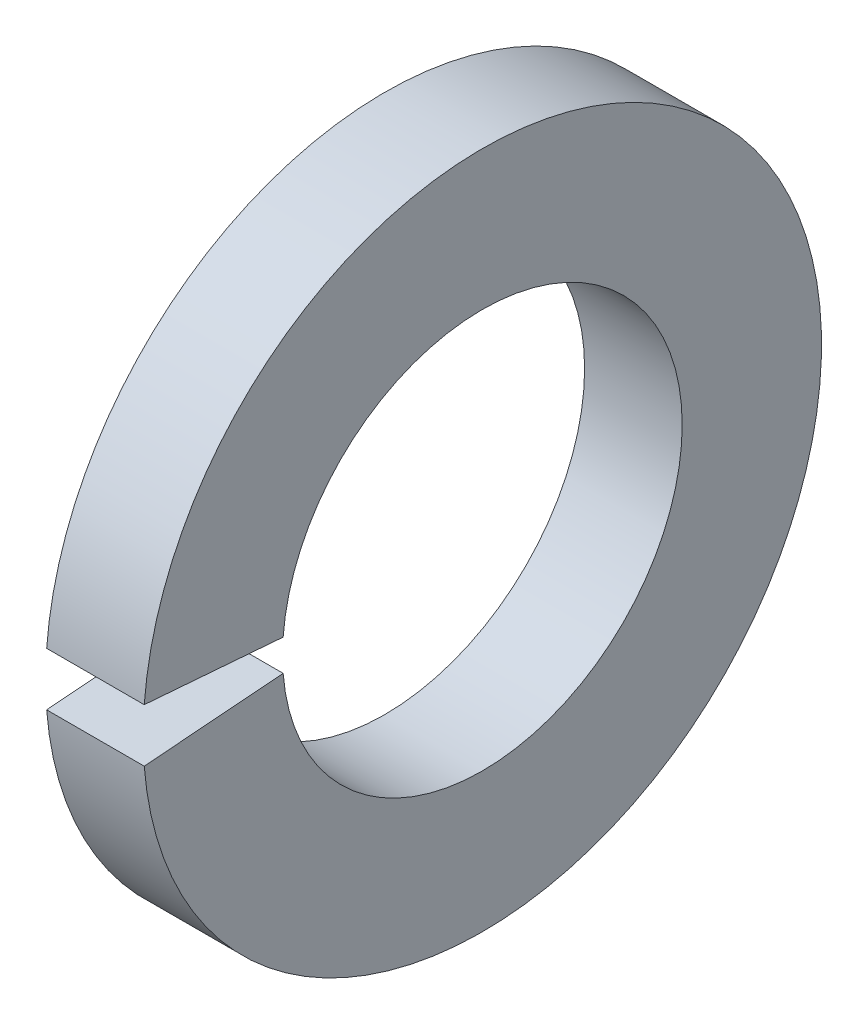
SolidWorks part; units mm, degrees
ref_plane "Plane1" through (0, 0, 0) normal (0, 0, 1) x (1, 0, 0)
ref_plane "Plane2" through (0, 0, 0) normal (0, 1, 0) x (1, 0, 0)
ref_plane "Plane3" through (0, 0, 0) normal (1, 0, 0) x (0, 0, -1)
sketch "Sketch1" plane through (0, 0, 0) normal (0, 0, 1) x (1, 0, 0)
  line L0 (-34.925, 0) -> (9.525, 0) construction
  line L1 (0, 6.5024) -> (0, 11.0363)
  line L2 (0, 11.0363) -> (-3.175, 11.0363)
  line L3 (-3.175, 11.0363) -> (-3.175, 6.5024)
  line L4 (-3.175, 6.5024) -> (0, 6.5024)
  dimension "Thickness" = 3.175
  dimension "Inside_dia" = 13.0048
  dimension "Outside_dia" = 22.0726
revolve "Base-Revolve" add sketch "Sketch1" angle 360 about L0
sketch "Sketch2" plane through (0, 0, 0) normal (-1, 0, 0) x (0, -1, 0)
  line L0 (0, 0) -> (0.8832, 11.2223)
  line L1 (0, -3.175) -> (0, 12.7) construction
  line L2 (0, 0) -> (-0.8832, 11.2223)
  arc A0 (0.8832, 11.2223) -> (-0.8832, 11.2223) centre (0, 0) ccw
  dimension "D1" = 11.257
  dimension "Gap_ang" = 9
extrude "Gap" cut sketch "Sketch2" along normal through all
equation "\"D1@Sketch2\" = \"Outside_dia@Sketch1\" * 0.51"
